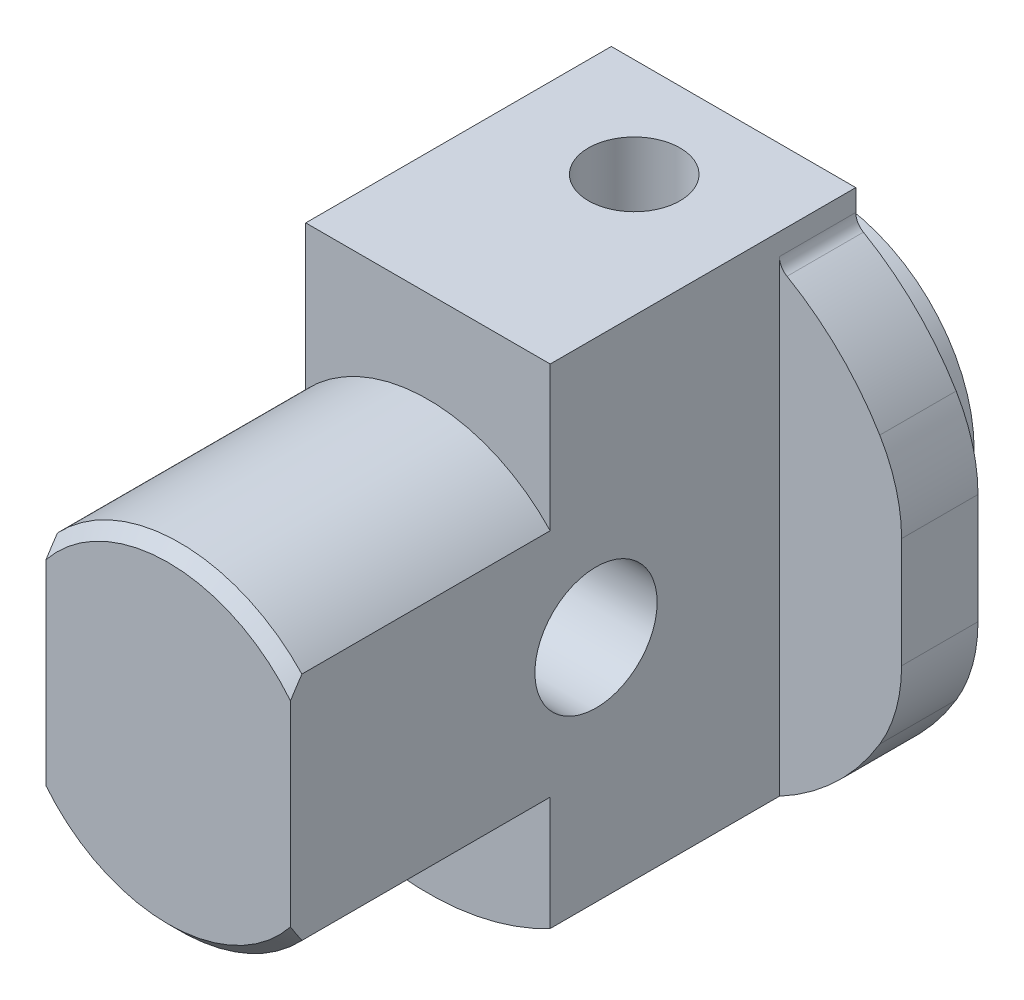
SolidWorks part; units mm, degrees
ref_plane "face" through (0, 0, 0) normal (0, 0, 1) x (1, 0, 0)
ref_plane "dessus" through (0, 0, 0) normal (0, 1, 0) x (1, 0, 0)
ref_plane "gauche" through (0, 0, 0) normal (1, 0, 0) x (0, 0, -1)
sketch "Esquisse1" plane through (0, 0, 0) normal (0, 0, 1) x (1, 0, 0)
  line L0 (0, 20) -> (0, -10) construction
  line L1 (-8, 17) -> (8, 17)
  line L2 (8, 17) -> (8, 15.5885)
  line L3 (0, 17) -> (0, -20) construction
  line L4 (-8, 17) -> (-8, 15.5885)
  arc A0 (-8.5, 14.7224) -> (8.5, 14.7224) centre (0, 0) ccw
  arc A1 (8.5, 14.7224) -> (8, 15.5885) centre (9, 15.5885) cw
  arc A2 (-8.5, 14.7224) -> (-8, 15.5885) centre (-9, 15.5885) ccw
  point P8 (0, 12.5)
  point P11 (8, 15)
  dimension "D1" = 34
  dimension "D4" = 1
  dimension "D2" = 17
  dimension "D3" = 8
extrude "Base-Extrusion" add sketch "Esquisse1" along normal blind 20
sketch "Esquisse2" plane through (0, 0, 20) normal (0, 0, 1) x (1, 0, 0)
  circle A0 centre (0, 0) radius 11
  dimension "D1" = 22
extrude "Boss.-Extru.1" add sketch "Esquisse2" along normal blind 17
chamfer "Chanfrein1" distance 0.75 angle 45
sketch "Esquisse3" plane through (0, 0, 0) normal (0, 0, -1) x (-1, 0, 0)
  circle A0 centre (0, 0) radius 9
  dimension "D1" = 18
extrude "Boss.-Extru.2" add sketch "Esquisse3" along normal blind 3
sketch "Esquisse4" plane through (0, 0, -3) normal (0, 0, -1) x (-1, 0, 0)
  circle A0 centre (0, 0) radius 9.75
  dimension "D1" = 19.5
extrude "Boss.-Extru.3" add sketch "Esquisse4" along normal blind 3
sketch "Esquisse7" plane through (0, 17, 0) normal (0, 1, 0) x (-1, 0, 0)
  line L0 (8, 0) -> (-8, 0) construction
  circle A0 centre (0, 6.5) radius 3
  dimension "D1" = 6
  dimension "D2" = 6.5
extrude "Enlèv. mat.-Extru.5" cut sketch "Esquisse7" against normal blind 22
chamfer "Chanfrein4" distance 2.9 angle 30
sketch "Esquisse5" plane through (0, 0, -6) normal (0, 0, -1) x (-1, 0, 0)
  circle A0 centre (0, 0) radius 2.5
  dimension "D1" = 5
extrude "Enlèv. mat.-Extru.6" cut sketch "Esquisse5" against normal up to next
sketch "Esquisse8" plane through (0, 17, 0) normal (0, 1, 0) x (-1, 0, 0)
  line L0 (0, -6.4115) -> (0, 29.115) construction
  line L1 (0, 20) -> (0, 0) construction
  line L2 (-8, 5) -> (-20, 5)
  line L3 (-8, 5) -> (-8, 45)
  line L4 (-20, 45) -> (-8, 45)
  line L5 (-20, 45) -> (-20, 5)
  line L6 (8, 5) -> (20, 5)
  line L7 (8, 5) -> (8, 45)
  line L8 (20, 45) -> (8, 45)
  line L9 (20, 45) -> (20, 5)
  line L10 (8, 0) -> (-8, 0) construction
  point P9 (0, 5)
  point P11 (0, 20)
  dimension "D1" = 5
  dimension "D2" = 40
  dimension "D3" = 8
extrude "Enlèv. mat.-Extru.7" cut sketch "Esquisse8" against normal through all
sketch "Esquisse9" plane through (0, 0, -6) normal (0, 0, -1) x (-1, 0, 0)
  circle A0 centre (0, 0) radius 6.25
  dimension "D1" = 12.5
extrude "Enlèv. mat.-Extru.8" cut sketch "Esquisse9" against normal blind 1.5
sketch "Esquisse10" plane through (0, 0, -4.5) normal (0, 0, -1) x (-1, 0, 0)
  circle A0 centre (0, 0) radius 4.75
  dimension "D1" = 9.5
extrude "Enlèv. mat.-Extru.9" cut sketch "Esquisse10" against normal blind 4
chamfer "Chanfrein5" distance 0.5 angle 45
sketch "Esquisse11" plane through (8, 0, 0) normal (1, 0, 0) x (0, 0, -1)
  line L1 (-37, 6.408) -> (-37, -6.408) construction
  circle A0 centre (-17, 0) radius 4
  dimension "D1" = 8
  dimension "D2" = 20
extrude "Enlèv. mat.-Extru.10" cut sketch "Esquisse11" against normal up to next
sketch "Esquisse12" plane through (0, 0, 5) normal (0, 0, 1) x (1, 0, 0)
  line L1 (16, 20) -> (36, 20)
  line L2 (16, 20) -> (16, -20)
  line L3 (16, -20) -> (36, -20)
  line L4 (36, 20) -> (36, -20)
  line L5 (-16, 20) -> (-36, 20)
  line L6 (-16, 20) -> (-16, -20)
  line L7 (-16, -20) -> (-36, -20)
  line L8 (-36, 20) -> (-36, -20)
  dimension "D1" = 32
  dimension "D2" = 16
extrude "Enlèv. mat.-Extru.11" cut sketch "Esquisse12" against normal through all
fillet "Congé1" radius 10
